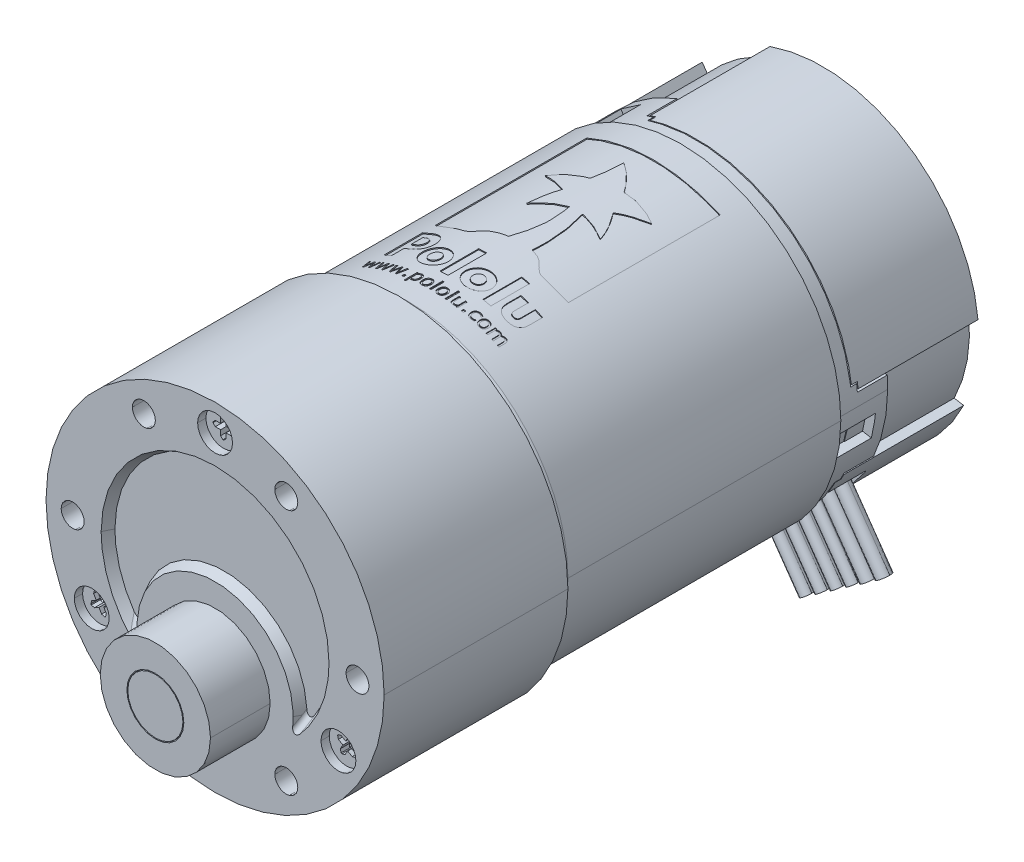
SolidWorks part; units mm, degrees
ref_plane "Plan de face" through (0, 0, 0) normal (0, 0, 1) x (1, 0, 0)
ref_plane "Plan de dessus" through (0, 0, 0) normal (0, 1, 0) x (1, 0, 0)
ref_plane "Plan de droite" through (0, 0, 0) normal (1, 0, 0) x (0, 0, -1)
imported_body "37d-gearmotor-6-10-encoder.step<1>"
sketch "Esquisse1" plane through (0, 0, 41.925) normal (0, 0, 1) x (1, 0, 0)
  circle A0 centre (19.925, -7) radius 3
extrude "Enlèv. mat.-Extru.1" cut sketch "Esquisse1" against normal up to surface (15.5 mm away)
ref_plane "plan par axes" through (19.925, 0, 0) normal (1, 0, 0) x (0, 0, -1)
